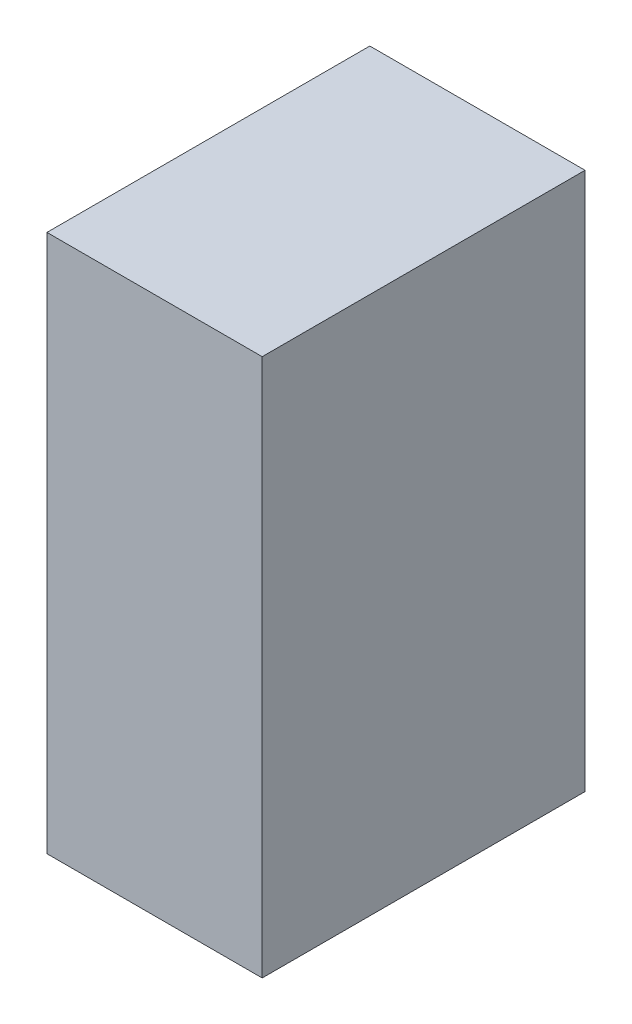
SolidWorks part; units mm, degrees
ref_plane "Ebene vorne" through (0, 0, 0) normal (0, 0, 1) x (1, 0, 0)
ref_plane "Ebene oben" through (0, 0, 0) normal (0, 1, 0) x (1, 0, 0)
ref_plane "Ebene rechts" through (0, 0, 0) normal (1, 0, 0) x (0, 0, -1)
sketch "Skizze1" plane through (0, 0, 0) normal (0, 0, 1) x (1, 0, 0)
  line L1 (0, 0) -> (20, 0)
  line L2 (0, 0) -> (0, 50)
  line L3 (0, 50) -> (20, 50)
  line L4 (20, 0) -> (20, 50)
  dimension "D1" = 20
  dimension "D2" = 50
extrude "Aufsatz-Linear austragen1" add sketch "Skizze1" against normal blind 30
